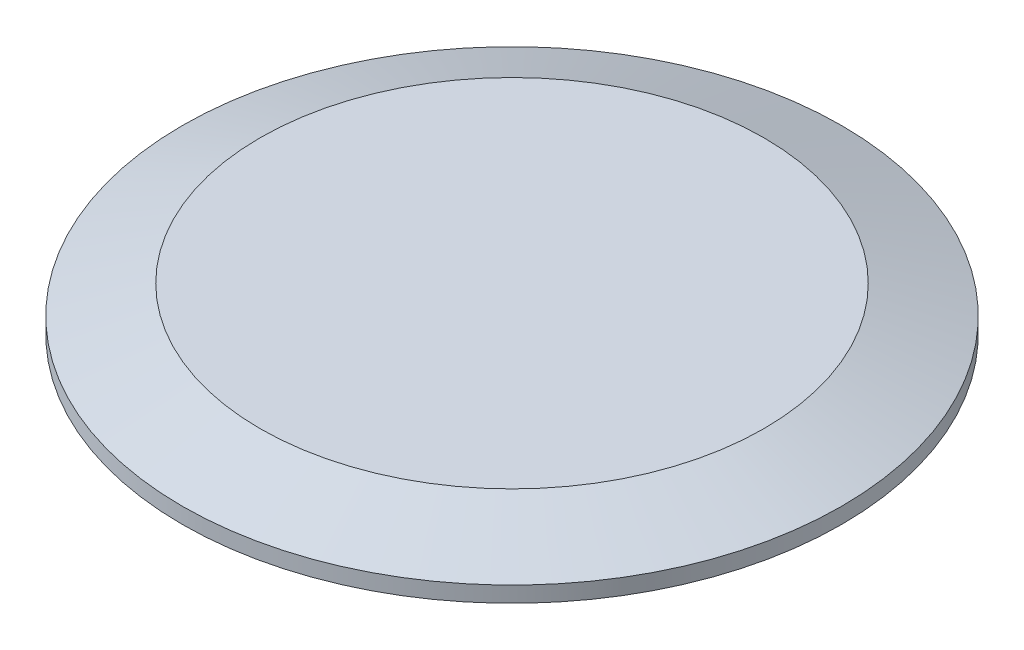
SolidWorks part; units mm, degrees
ref_plane "Front Plane" through (0, 0, 0) normal (0, 0, 1) x (1, 0, 0)
ref_plane "Top Plane" through (0, 0, 0) normal (0, 1, 0) x (1, 0, 0)
ref_plane "Right Plane" through (0, 0, 0) normal (1, 0, 0) x (0, 0, -1)
sketch "Sketch1" plane through (0, 0, 0) normal (0, 0, 1) x (1, 0, 0)
  line L0 (0, 0) -> (-52.9825, 0)
  line L1 (-59.4614, 0) -> (-59.4614, 2.8448)
  line L2 (-59.4614, 2.8448) -> (-45.4344, 7.9502)
  line L3 (-45.4344, 7.9502) -> (0, 7.9502)
  line L4 (0, 7.9502) -> (0, 0) construction
  line L5 (-56.6185, 0) -> (-59.4614, 0)
  line L6 (0, 0) -> (0, 7.9502)
  arc A0 (-53.705, 0.4745) -> (-55.896, 0.4745) centre (-54.8005, 0) ccw
  arc A1 (-52.9825, 0) -> (-53.705, 0.4745) centre (-52.9825, 0.7874) cw
  arc A2 (-56.6185, 0) -> (-55.896, 0.4745) centre (-56.6185, 0.7874) ccw
  point P13 (-55.9943, 0)
  dimension "D1" = 2.3876
  dimension "D2" = 0.7874
  dimension "D3" = 59.4614
  dimension "D4" = 54.8005
  dimension "D5" = 2.8448
  dimension "D6" = 20
  dimension "D7" = 7.9502
revolve "Revolve1" add sketch "Sketch1" angle 360 about L4
